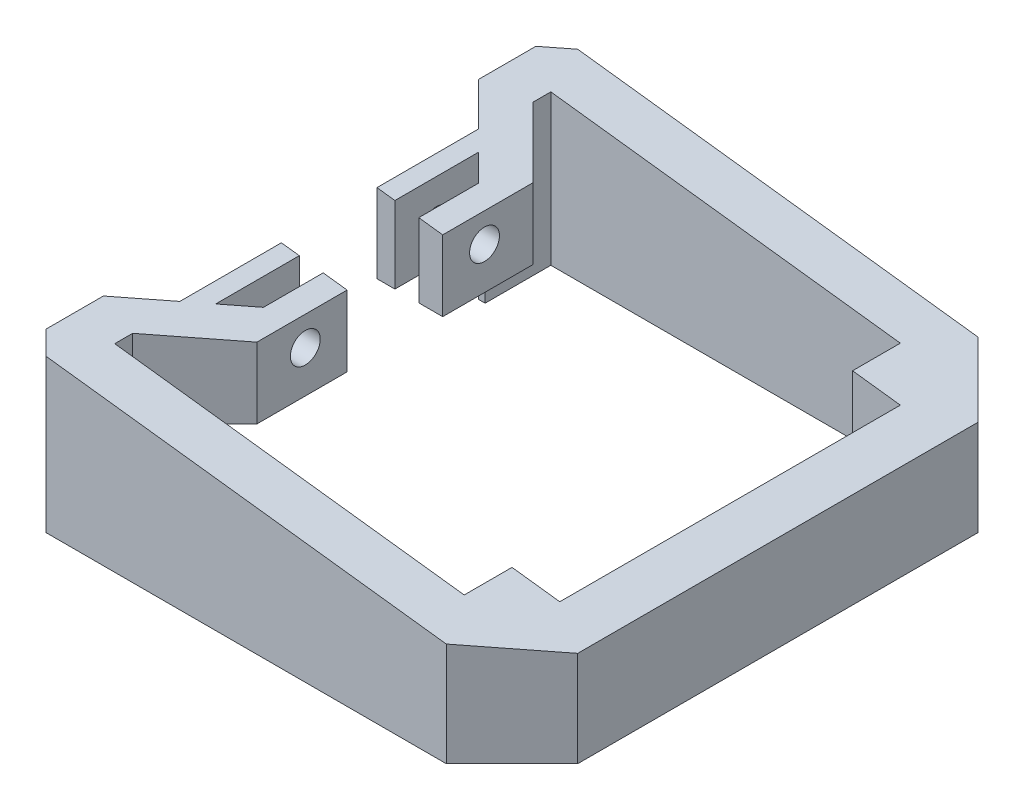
SolidWorks part; units mm, degrees
ref_plane "Front Plane" through (0, 0, 0) normal (0, 0, 1) x (1, 0, 0)
ref_plane "Top Plane" through (0, 0, 0) normal (0, 1, 0) x (1, 0, 0)
ref_plane "Right Plane" through (0, 0, 0) normal (1, 0, 0) x (0, 0, -1)
sketch "Sketch1" plane through (0, 0, 0) normal (0, 1, 0) x (1, 0, 0)
  line L0 (31, 1.5) -> (31, -2.5)
  line L1 (31, -2.5) -> (35, -2.5)
  line L2 (35, -2.5) -> (35, -31)
  line L3 (35, -31) -> (31, -31)
  line L4 (31, -31) -> (31, -35)
  line L5 (31, -35) -> (1.75, -35)
  line L6 (1.75, -35) -> (1.75, 1.5) construction
  line L7 (1.75, 1.5) -> (31, 1.5)
  line L8 (39, 0) -> (39, -33.5)
  line L9 (35, -16.75) -> (39, -16.75) construction
  line L10 (0, 5.5) -> (33.5, 5.5)
  line L11 (33.5, 5.5) -> (39, 0)
  line L12 (39, -33.5) -> (33.5, -39)
  line L13 (33.5, -39) -> (0, -39)
  line L14 (-3.25, -16.75) -> (1.75, -16.75) construction
  line L15 (0, -39) -> (-3.25, -35.75) construction
  line L16 (0, 5.5) -> (-3.25, 2.25) construction
  line L17 (-3.25, 2.25) -> (-3.25, -35.75) construction
  line L18 (4.95, 1.5) -> (4.95, -35) construction
  line L19 (-3.25, 2.25) -> (-3.25, -2.5) construction
  line L20 (-3.25, -2.5) -> (4.95, -10.7) construction
  line L21 (-3.25, -35.75) -> (-3.25, -31) construction
  line L22 (-3.25, -31) -> (4.95, -22.8) construction
  line L23 (4.95, -22.8) -> (4.95, -10.7)
  line L24 (1.75, 1.5) -> (1.75, 0)
  line L25 (1.75, -35) -> (1.75, -33.5)
  line L26 (6.95, 1.5) -> (6.95, -35) construction
  line L27 (1.75, 0) -> (6.95, -5.2)
  line L28 (1.75, -33.5) -> (6.95, -28.3)
  line L29 (6.95, -5.2) -> (6.95, -28.3)
  line L30 (2.95, -8.7) -> (2.95, -24.8)
  line L31 (1.45, -7.2) -> (1.45, -26.3)
  line L32 (-3.25, -2.5) -> (1.45, -7.2) construction
  line L33 (2.95, -8.7) -> (4.95, -10.7)
  line L34 (2.95, -24.8) -> (4.95, -22.8)
  line L35 (1.45, -26.3) -> (-3.25, -31) construction
  line L36 (-1.75, -29.5) -> (-1.75, -37.25)
  line L37 (-1.75, -29.5) -> (1.45, -26.3)
  line L38 (0, -39) -> (-1.75, -37.25)
  line L39 (-1.75, 3.75) -> (-1.75, -4)
  line L40 (-1.75, 3.75) -> (0, 5.5)
  line L41 (-1.75, -4) -> (1.45, -7.2)
  circle A0 centre (0, 0) radius 1.1
  circle A1 centre (33.5, 0) radius 1.1
  circle A2 centre (0, -33.5) radius 1.1
  circle A3 centre (33.5, -33.5) radius 1.1
  dimension "D1" = 2.2
  dimension "D2" = 33.5
  dimension "D3" = 33.5
  dimension "D4" = 2.5
  dimension "D6" = 2.5
  dimension "D9" = 1.75
  dimension "D14" = 5
  dimension "D5" = 2.5
  dimension "D7" = 4
  dimension "D8" = 4
  dimension "D10" = 4
  dimension "D11" = 4
  dimension "D12" = 4
  dimension "D13" = 225
  dimension "D15" = 8.2
  dimension "D16" = 135
  dimension "D17" = 10.2
  dimension "D18" = 2
  dimension "D19" = 1.5
  dimension "D20" = 1.75
extrude "Boss-Extrude1" add sketch "Sketch1" along normal blind 6
sketch "Sketch2" plane through (0, 6, 0) normal (0, 1, 0) x (1, 0, 0)
  line L0 (4.95, -16.75) -> (35, -16.75) construction
  line L1 (4.95, -10.7) -> (4.95, -22.8) construction
  line L2 (35, -31) -> (35, -2.5) construction
  line L3 (4.95, -7.75) -> (4.95, -25.75)
  line L4 (1.75, -33.5) -> (1.75, -35)
  line L5 (6.95, -28.3) -> (6.95, -5.2)
  line L6 (6.95, -5.2) -> (1.75, 0)
  line L7 (6.95, -5.2) -> (6.95, -28.3) construction
  line L8 (1.75, -35) -> (31, -35)
  line L9 (31, -35) -> (31, -31)
  line L10 (31, -31) -> (35, -31)
  line L11 (1.75, 0) -> (6.95, -5.2) construction
  line L12 (35, -31) -> (35, -2.5)
  line L14 (35, -2.5) -> (31, -2.5)
  line L15 (0, 5.5) -> (-1.75, 3.75)
  line L16 (-1.75, 3.75) -> (-1.75, -1.05)
  line L17 (-1.75, -1.05) -> (4.95, -7.75) construction
  line L18 (6.95, -28.3) -> (1.75, -33.5)
  line L19 (31, -2.5) -> (31, 1.5)
  line L21 (31, 1.5) -> (1.75, 1.5)
  line L22 (0, -39) -> (-1.75, -37.25)
  line L23 (-1.75, -37.25) -> (-1.75, -32.45)
  line L24 (-1.75, -32.45) -> (4.95, -25.75) construction
  line L25 (1.45, -4.25) -> (1.45, -29.25)
  line L26 (2.95, -5.75) -> (2.95, -27.75)
  line L27 (-1.75, -1.05) -> (1.45, -4.25)
  line L28 (2.95, -5.75) -> (4.95, -7.75)
  line L29 (2.95, -27.75) -> (4.95, -25.75)
  line L30 (1.45, -29.25) -> (-1.75, -32.45)
  line L31 (1.75, 1.5) -> (1.75, 0)
  line L32 (0, 5.5) -> (33.5, 5.5)
  line L33 (33.5, 5.5) -> (39, 0)
  line L34 (39, 0) -> (39, -33.5)
  line L35 (39, -33.5) -> (33.5, -39)
  line L36 (33.5, -39) -> (0, -39)
  line L37 (2.95, -8.7) -> (2.95, -24.8) construction
  point P8 (4.95, -16.75)
  dimension "D1" = 18
  dimension "D2" = 1.5
extrude "Boss-Extrude2" add sketch "Sketch2" along normal blind 7
sketch "Sketch4" plane through (6.95, 0, 0) normal (1, 0, 0) x (0, 0, -1)
  line L0 (-24.25, 9.5) -> (-9.25, 9.5) construction
  line L1 (-16.75, 13) -> (-16.75, 6) construction
  line L2 (-28.3, 13) -> (-5.2, 13) construction
  line L3 (-24.25, 9.5) -> (-23.7557, 9.5) construction
  line L4 (-9.25, 9.5) -> (-9.7443, 9.5) construction
  line L5 (-33.5, 6) -> (0, 6) construction
  circle A0 centre (-24.25, 9.5) radius 1.25
  circle A1 centre (-9.25, 9.5) radius 1.25
  point P12 (-16.75, 9.5)
  dimension "D1" = 2.5
  dimension "D2" = 15
extrude "Cut-Extrude1" cut sketch "Sketch4" against normal blind 2
sketch "Sketch7" plane through (4.95, 0, 0) normal (-1, 0, 0) x (0, 0, 1)
  line L0 (12.75, 13) -> (20.75, 13)
  line L3 (7.75, 13) -> (25.75, 13) construction
  line L4 (20.75, 13) -> (20.75, 0)
  line L5 (12.75, 13) -> (12.75, 0)
  line L6 (0, 4) -> (33.5, 4) construction
  line L7 (10.7, 0) -> (22.8, 0) construction
  line L8 (16.75, 4) -> (16.75, 0) construction
  line L9 (14.75, 4) -> (14.75, 0) construction
  line L10 (18.75, 4) -> (18.75, 0) construction
  line L11 (14.75, 2) -> (18.75, 2) construction
  line L12 (33.5, 13) -> (33.5, 0) construction
  line L15 (12.75, 0) -> (20.75, 0)
  point P21 (16.75, 2)
  dimension "D2" = 4
  dimension "D3" = 4
  dimension "D4" = 8
extrude "Cut-Extrude3" cut sketch "Sketch7" against normal up to next and the other way blind 6
sketch "Sketch8" plane through (2.95, 0, 0) normal (1, 0, 0) x (0, 0, -1)
  circle A0 centre (-24.25, 9.5) radius 0.75
  circle A1 centre (-9.25, 9.5) radius 0.75
  dimension "D1" = 1.5
extrude "Cut-Extrude4" cut sketch "Sketch8" against normal blind 2
sketch "Sketch9" plane through (0, 0, 39) normal (0, 0, 1) x (1, 0, 0)
  line L0 (-1.75, 4) -> (39, 4) construction
  line L1 (39, 13) -> (39, 0) construction
  line L2 (-1.75, 13) -> (39, 8)
  line L3 (39, 8) -> (39, 13)
  line L4 (39, 13) -> (-1.75, 13)
  line L5 (-1.75, 13) -> (-1.75, 0) construction
  dimension "D1" = 5
extrude "Cut-Extrude5" cut sketch "Sketch9" against normal through all
sketch "Sketch10" plane through (0, 0, 0) normal (0, -1, 0) x (1, 0, 0)
  line L0 (-1.75, 29.5) -> (1.75, 29.5) construction
  line L1 (-1.75, 32.45) -> (-1.75, 29.5)
  line L2 (1.75, 29.5) -> (1.75, 33.5)
  line L3 (1.75, 33.5) -> (6.95, 28.3)
  line L4 (6.95, 28.3) -> (6.95, 5.2)
  line L5 (-1.75, 32.45) -> (1.2, 29.5)
  line L6 (6.95, 5.2) -> (1.75, 0)
  line L7 (1.75, 0) -> (1.75, 4)
  line L8 (1.75, 4) -> (-1.75, 4) construction
  line L9 (-1.75, 32.45) -> (1.45, 29.25) construction
  line L10 (-1.75, 4) -> (1.45, 7.2)
  line L11 (1.45, 7.2) -> (1.45, 26.3)
  line L12 (1.45, 26.3) -> (-1.75, 29.5)
  line L13 (1.2, 29.5) -> (1.75, 29.5)
  line L14 (-1.75, 4) -> (-1.75, 1.05)
  line L15 (-1.75, 1.05) -> (1.2, 4)
  line L16 (1.2, 4) -> (1.75, 4)
extrude "Cut-Extrude6" cut sketch "Sketch10" against normal up to surface (6 mm away)
